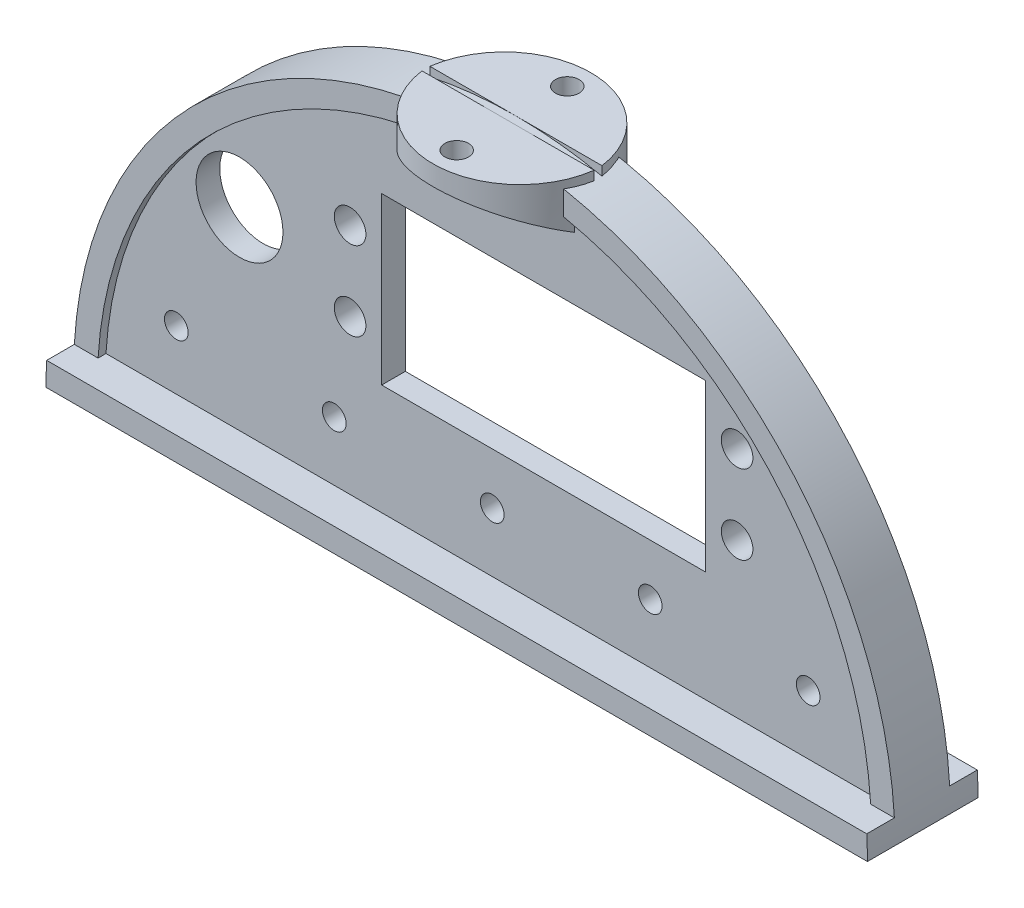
SolidWorks part; units mm, degrees
ref_plane "前视" through (0, 0, 0) normal (0, 0, 1) x (1, 0, 0)
ref_plane "上视" through (0, 0, 0) normal (0, 1, 0) x (1, 0, 0)
ref_plane "右视" through (0, 0, 0) normal (1, 0, 0) x (0, 0, -1)
sketch "草图1" plane through (0, 0, 0) normal (0, 0, 1) x (1, 0, 0)
  line L0 (0, 0) -> (104, 0)
  line L1 (58.5, 38) -> (58.5, 17) construction
  line L2 (38, 38) -> (79, 38)
  line L3 (38, 38) -> (38, 17)
  line L4 (38, 17) -> (79, 17)
  line L5 (79, 38) -> (79, 17)
  line L6 (38, 27.5) -> (79, 27.5) construction
  line L7 (52, 0) -> (52, 52) construction
  arc A0 (0, 0) -> (104, 0) centre (52, 0) cw
  circle A1 centre (83, 32.5) radius 2
  circle A2 centre (83, 22.5) radius 2
  circle A3 centre (34, 22.5) radius 2
  circle A4 centre (34, 32.5) radius 2
  circle A5 centre (20, 27.5) radius 5.5
  circle A6 centre (52, 10.5) radius 1.5
  circle A7 centre (32, 10.5) radius 1.5
  circle A8 centre (12, 10.5) radius 1.5
  circle A9 centre (72, 10.5) radius 1.5
  circle A10 centre (92, 10.5) radius 1.5
  dimension "D6" = 4
  dimension "D7" = 10
  dimension "D8" = 49
  dimension "D9" = 11
  dimension "D10" = 18
  dimension "D11" = 3
  dimension "D12" = 10.5
  dimension "D13" = 20
  dimension "D14" = 20
  dimension "D15" = 20
  dimension "D16" = 20
  dimension "D1" = 104
  dimension "D2" = 41
  dimension "D3" = 21
  dimension "D4" = 17
  dimension "D5" = 25
extrude "凸台-拉伸1" add sketch "草图1" along normal mid plane 14
sketch "草图2" plane through (0, 0, 7) normal (0, 0, 1) x (1, 0, 0)
  line L0 (0.0866, 3) -> (103.9134, 3)
  line L1 (0, 0) -> (104, 0) construction
  arc A0 (104, 0) -> (0, 0) centre (52, 0) ccw construction
  arc A1 (103.9134, 3) -> (0.0866, 3) centre (52, 0) ccw
  dimension "D1" = 3
extrude "切除-拉伸1" cut sketch "草图2" against normal blind 3.5
sketch "草图3" plane through (0, 0, 3.5) normal (0, 0, 1) x (1, 0, 0)
  line L0 (0.0866, 3) -> (103.9134, 3) construction
  line L1 (3.0919, 3) -> (100.9081, 3)
  arc A1 (103.9134, 3) -> (0.0866, 3) centre (52, 0) ccw construction
  arc A2 (100.9081, 3) -> (3.0919, 3) centre (52, 0) ccw
  dimension "D1" = 3
  dimension "D2" = 49
extrude "切除-拉伸2" cut sketch "草图3" against normal blind 1
mirror "镜向1" about plane through (0, 0, 0) normal (0, 0, 1) of "切除-拉伸1"
sketch "草图7" plane through (0, 0, -3.5) normal (0, 0, -1) x (-1, 0, 0)
  line L0 (-0.0866, 3) -> (-103.9134, 3) construction
  line L1 (-3.0919, 3) -> (-100.9081, 3)
  arc A0 (-3.0919, 3) -> (-100.9081, 3) centre (-52, 0) ccw construction
  arc A1 (-3.0919, 3) -> (-100.9081, 3) centre (-52, 0) ccw
extrude "切除-拉伸3" cut sketch "草图7" against normal blind 3
ref_plane "基准面1" through (0, 52, 0) normal (0, 1, 0) x (1, 0, 0)
ref_plane "基准面2" through (0, 45, 0) normal (0, 1, 0) x (1, 0, 0)
sketch "草图8" plane through (0, 45, 0) normal (0, 1, 0) x (1, 0, 0)
  line L0 (52, -7) -> (52, 7) construction
  line L1 (0, -7) -> (104, -7) construction
  line L2 (0, 7) -> (104, 7) construction
  line L4 (100.9081, 0.5) -> (3.0919, 0.5) construction
  line L5 (41.1028, 0.5) -> (62.8972, 0.5)
  arc A0 (41.1028, 0.5) -> (62.8972, 0.5) centre (52, -1) cw
  dimension "D1" = 11
  dimension "D2" = 1.5
extrude "凸台-拉伸2" add sketch "草图8" along normal up to surface (7 mm away) separate body
ref_plane "基准面3" through (52, 0, 0) normal (1, 0, 0) x (0, 0, -1)
sketch "草图10" plane through (52, 0, 0) normal (1, 0, 0) x (0, 0, -1)
  line L0 (10, 49.5) -> (0.5, 45)
  line L2 (0.5, 45) -> (10, 45)
  line L3 (10, 45) -> (10, 52) construction
  line L4 (10, 45) -> (10, 49.5)
  dimension "D1" = 4.5
extrude "切除-拉伸4" cut sketch "草图10" against normal mid plane 23
mirror "镜向5" about plane through (0, 0, 0) normal (0, 0, 1) of "切除-拉伸4", "凸台-拉伸2"
sketch "草图11" plane through (0, 52, 0) normal (0, 1, 0) x (1, 0, 0)
  line L0 (52, -10) -> (52, 10) construction
  line L1 (52, 0) -> (104, 0) construction
  line L2 (104, -7) -> (104, 7) construction
  arc A0 (41.1028, -0.5) -> (62.8972, -0.5) centre (52, 1) ccw construction
  arc A1 (62.8972, 0.5) -> (41.1028, 0.5) centre (52, -1) ccw construction
  circle A2 centre (52, 7) radius 1.5
  circle A3 centre (52, -7) radius 1.5
  dimension "D1" = 14
  dimension "D2" = 3
extrude "切除-拉伸5" cut sketch "草图11" against normal blind 23
